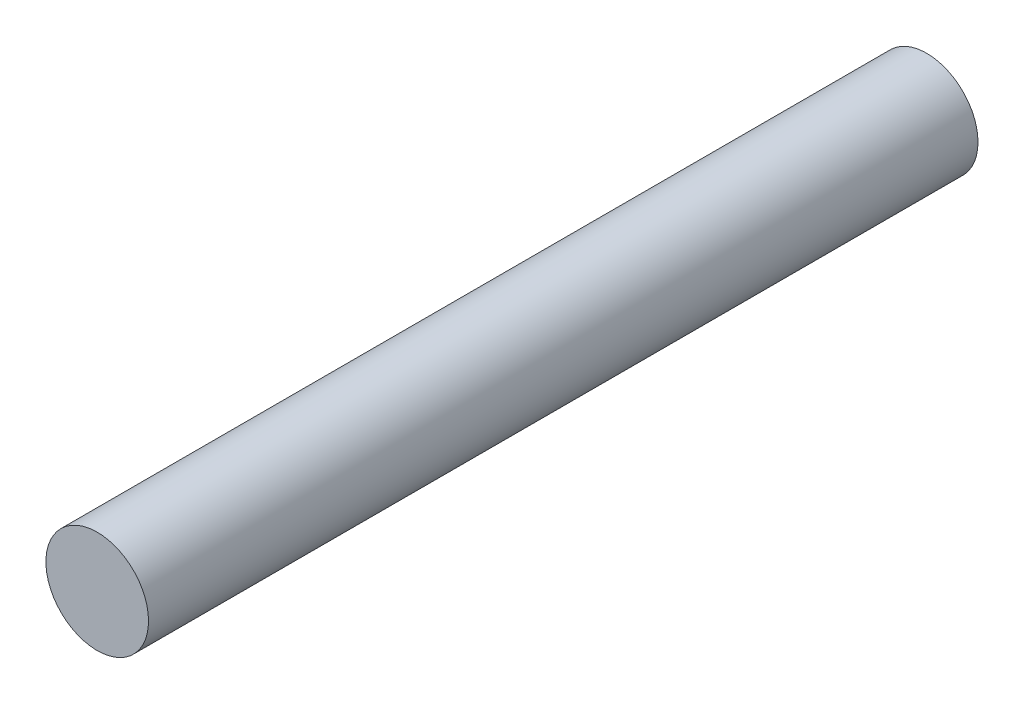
SolidWorks part; units mm, degrees
ref_plane "Front Plane" through (0, 0, 0) normal (0, 0, 1) x (1, 0, 0)
ref_plane "Top Plane" through (0, 0, 0) normal (0, 1, 0) x (1, 0, 0)
ref_plane "Right Plane" through (0, 0, 0) normal (1, 0, 0) x (0, 0, -1)
sketch "Sketch1" plane through (0, 0, 0) normal (0, 0, 1) x (1, 0, 0)
  circle A0 centre (0, 0) radius 6
  dimension "D1" = 12
extrude "Extrude1" add sketch "Sketch1" along normal blind 97
